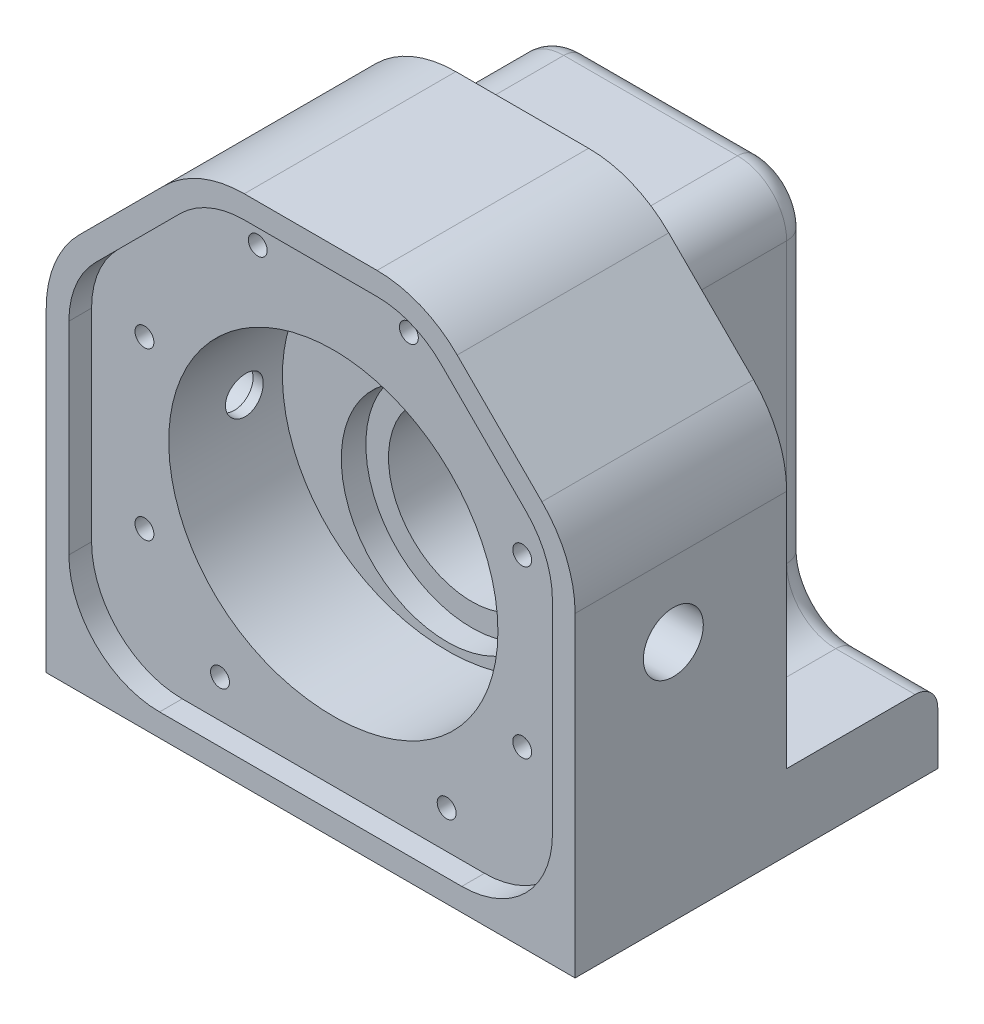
SolidWorks part; units mm, degrees
ref_plane "Face" through (0, 0, 0) normal (0, 0, 1) x (1, 0, 0)
ref_plane "Dessus" through (0, 0, 0) normal (0, 1, 0) x (1, 0, 0)
ref_plane "Droite" through (0, 0, 0) normal (1, 0, 0) x (0, 0, -1)
sketch "Esquisse1" plane through (0, 0, 0) normal (0, 0, 1) x (1, 0, 0)
  line L1 (-35, -32) -> (35, -32)
  line L2 (-35, -32) -> (-35, 38)
  line L3 (-35, 38) -> (35, 38)
  line L4 (35, -32) -> (35, 38)
  dimension "D1" = 70
  dimension "D2" = 70
  dimension "D3" = 32
  dimension "D4" = 35
extrude "brut 70 x 70 x 50" add sketch "Esquisse1" along normal blind 50
sketch "Esquisse 1" plane through (0, 0, 0) normal (0, 0, -1) x (-1, 0, 0)
  line L4 (35, -32) -> (35, 38)
  line L5 (35, 38) -> (-35, 38)
  line L6 (-35, 38) -> (-35, -32)
  line L7 (-35, -32) -> (35, -32)
  line L8 (35, -32) -> (35, 38)
  line L9 (35, 38) -> (-35, 38)
  line L10 (-35, 38) -> (-35, -32)
  line L11 (-35, -32) -> (35, -32)
  dimension "D1" = 0
extrude "Surfaçage ph 10" cut sketch "Esquisse 1" against normal blind 1
sketch "Esquisse 2" plane through (0, 0, 1) normal (0, 0, -1) x (-1, 0, 0)
  line L0 (-35, -22) -> (-24.5, -22)
  line L1 (-18, -15.5) -> (-18, 21.5)
  line L2 (-11.5, 28) -> (11.5, 28)
  line L3 (18, 21.5) -> (18, -15.5)
  line L4 (-35, -32) -> (35, -32)
  line L5 (35, -32) -> (35, 38)
  line L6 (35, 38) -> (-35, 38)
  line L7 (-35, 38) -> (-35, -32)
  line L8 (-35, -32) -> (35, -32)
  line L9 (35, -32) -> (35, -22)
  line L11 (-35, -22) -> (-35, -32)
  line L12 (24.5, -22) -> (35, -22)
  arc A0 (-24.5, -22) -> (-18, -15.5) centre (-24.5, -15.5) ccw
  arc A1 (-18, 21.5) -> (-11.5, 28) centre (-11.5, 21.5) cw
  arc A2 (18, 21.5) -> (11.5, 28) centre (11.5, 21.5) ccw
  arc A3 (18, -15.5) -> (24.5, -22) centre (24.5, -15.5) ccw
  point P15 (-18, 28)
  point P18 (18, 28)
  dimension "D6" = 6.5
  dimension "D2" = 10
  dimension "D3" = 60
  dimension "D4" = 18
  dimension "D5" = 36
  dimension "D1" = 0
extrude "Contournage ph 10" cut sketch "Esquisse 2" against normal blind 20 flip side to cut
fillet "Arrondi ph 10" radius 3 9 edges at (29.75, -22, 1) (19.9038, -20.0962, 1) (18, 3, 1) (16.0962, 26.0962, 1) (0, 28, 1) (-16.0962, 26.0962, 1) (-18, 3, 1) (-19.9038, -20.0962, 1) (-29.75, -22, 1)
sketch "Esquisse 3" plane through (0, 0, 50) normal (0, 0, 1) x (1, 0, 0)
  line L4 (-35, 38) -> (-35, -32)
  line L5 (-35, -32) -> (35, -32)
  line L6 (35, -32) -> (35, 38)
  line L7 (35, 38) -> (-35, 38)
  line L8 (-35, 38) -> (-35, -32)
  line L9 (-35, -32) -> (35, -32)
  line L10 (35, -32) -> (35, 38)
  line L11 (35, 38) -> (-35, 38)
  dimension "D1" = 0
extrude "Surfaçage ph 20" cut sketch "Esquisse 3" against normal offset from surface (1 mm away) 48
sketch "Esquisse 4" plane through (0, 0, 49) normal (0, 0, 1) x (1, 0, 0)
  line L0 (-35, -32) -> (35, -32) construction
  line L1 (19.3934, 31.6066) -> (30.6066, 20.3934)
  line L2 (-19.3934, 31.6066) -> (-30.6066, 20.3934)
  line L3 (-35, 38) -> (-35, -32) construction
  line L4 (35, 38) -> (-35, 38)
  line L5 (-35, 38) -> (-35, -32)
  line L6 (-35, -32) -> (35, -32)
  line L7 (35, -32) -> (35, 38)
  line L9 (-35, 9.7868) -> (-35, -32)
  line L10 (-35, -32) -> (35, -32)
  line L11 (35, -32) -> (35, 9.7868)
  line L14 (-8.7868, 36) -> (8.7868, 36)
  arc A0 (-19.3934, 31.6066) -> (-8.7868, 36) centre (-8.7868, 21) cw
  arc A1 (-30.6066, 20.3934) -> (-35, 9.7868) centre (-20, 9.7868) ccw
  arc A2 (30.6066, 20.3934) -> (35, 9.7868) centre (20, 9.7868) cw
  arc A3 (19.3934, 31.6066) -> (8.7868, 36) centre (8.7868, 21) ccw
  point P14 (-15, 36)
  point P19 (15, 36)
  dimension "D6" = 20
  dimension "D7" = 15
  dimension "D8" = 15
  dimension "D2" = 135
  dimension "D3" = 135
  dimension "D4" = 68
  dimension "D5" = 30
  dimension "D1" = 0
extrude "Contour ph 20" cut sketch "Esquisse 4" against normal blind 30 flip side to cut
sketch "Esquisse 5" plane through (0, 0, 49) normal (0, 0, 1) x (1, 0, 0)
  circle A0 centre (0, -6) radius 8.25
  dimension "D1" = 16.5
  dimension "D2" = 6
extrude "Perçage Ø16,5  ph 20" cut sketch "Esquisse 5" against normal through all
sketch "Positions points" plane through (0, 0, 49) normal (0, 0, 1) x (1, 0, 0)
  point P0 (0, 21)
  point P1 (2.351, 20.875)
  point P2 (4.673, 20.5)
  point P3 (6.935, 19.883)
  point P5 (11.173, 17.961)
  point P6 (9.111, 19.032)
  point P7 (13.098, 16.687)
  point P8 (14.864, 15.228)
  point P9 (16.453, 13.608)
  point P10 (17.849, 11.849)
  point P11 (19.041, 9.978)
  point P12 (20.021, 8.019)
  point P13 (20.785, 6)
  point P14 (21.331, 3.947)
  point P15 (21.662, 1.884)
  point P16 (21.784, -0.163)
  point P17 (21.707, -2.172)
  point P18 (21.441, -4.124)
  point P19 (20.399, -7.785)
  point P20 (21, -6)
  point P21 (19.655, -9.466)
  point P22 (18.784, -11.033)
  point P23 (17.805, -12.481)
  point P24 (16.734, -13.803)
  point P25 (15.588, -15)
  point P26 (14.383, -16.071)
  point P27 (13.133, -17.019)
  point P28 (11.849, -17.849)
  point P29 (10.544, -18.566)
  point P30 (9.226, -19.176)
  point P31 (7.902, -19.687)
  point P32 (6.577, -20.104)
  point P33 (5.254, -20.435)
  point P34 (3.935, -20.686)
  point P35 (2.621, -20.862)
  point P36 (1.309, -20.966)
  point P37 (0, -21)
  point P40 (-1.309, -20.966)
  point P41 (-2.621, -20.862)
  point P42 (-3.935, -20.686)
  point P43 (-5.254, -20.435)
  point P44 (-6.577, -20.104)
  point P45 (-7.902, -19.687)
  point P46 (-9.226, -19.176)
  point P47 (-10.544, -18.566)
  point P48 (-11.849, -17.849)
  point P49 (-13.133, -17.019)
  point P50 (-14.383, -16.071)
  point P51 (-15.588, -15)
  point P52 (-16.734, -13.803)
  point P53 (-17.805, -12.481)
  point P54 (-18.784, -11.033)
  point P55 (-19.655, -9.466)
  point P56 (-21, -6)
  point P57 (-20.399, -7.785)
  point P58 (-21.441, -4.124)
  point P59 (-21.707, -2.172)
  point P60 (-21.784, -0.163)
  point P61 (-21.662, 1.884)
  point P62 (-21.331, 3.947)
  point P63 (-20.785, 6)
  point P64 (-20.021, 8.019)
  point P65 (-19.041, 9.978)
  point P66 (-17.849, 11.849)
  point P67 (-16.453, 13.608)
  point P68 (-14.864, 15.228)
  point P69 (-13.098, 16.687)
  point P70 (-9.111, 19.032)
  point P71 (-11.173, 17.961)
  point P72 (-6.935, 19.883)
  point P73 (-4.673, 20.5)
  point P74 (-2.351, 20.875)
curve "Courbe2"
sketch "Esquisse 6" plane through (0, 0, 49) normal (0, 0, 1) x (1, 0, 0)
  line L18 (8.7868, 33) -> (-8.7868, 33)
  line L19 (28.4853, 18.2721) -> (17.2721, 29.4853)
  line L20 (32, -29) -> (32, 9.7868)
  line L21 (-32, -29) -> (32, -29)
  line L22 (-32, 9.7868) -> (-32, -29)
  line L23 (-17.2721, 29.4853) -> (-28.4853, 18.2721)
  line L24 (8.7868, 33) -> (-8.7868, 33)
  line L25 (28.4853, 18.2721) -> (17.2721, 29.4853)
  line L26 (32, -17) -> (32, 9.7868)
  line L27 (-20, -29) -> (20, -29)
  line L28 (-32, 9.7868) -> (-32, -17)
  line L29 (-17.2721, 29.4853) -> (-28.4853, 18.2721)
  arc A8 (-20, -29) -> (-32, -17) centre (-20, -17) cw
  arc A9 (32, -17) -> (20, -29) centre (20, -17) cw
  arc A12 (-8.7868, 33) -> (-17.2721, 29.4853) centre (-8.7868, 21) ccw
  arc A13 (17.2721, 29.4853) -> (8.7868, 33) centre (8.7868, 21) ccw
  arc A14 (32, 9.7868) -> (28.4853, 18.2721) centre (20, 9.7868) ccw
  arc A15 (-28.4853, 18.2721) -> (-32, 9.7868) centre (-20, 9.7868) ccw
  arc A16 (-8.7868, 33) -> (-17.2721, 29.4853) centre (-8.7868, 21) ccw
  arc A17 (17.2721, 29.4853) -> (8.7868, 33) centre (8.7868, 21) ccw
  arc A18 (32, 9.7868) -> (28.4853, 18.2721) centre (20, 9.7868) ccw
  arc A19 (-28.4853, 18.2721) -> (-32, 9.7868) centre (-20, 9.7868) ccw
  dimension "D1" = 3
  dimension "D2" = 12
extrude "Logement pléxiglass ph 20" cut sketch "Esquisse 6" against normal blind 3
sketch "Esquisse 7" plane through (0, 0, 46) normal (0, 0, 1) x (1, 0, 0)
  point P0 (0, 21)
  dimension "D1" = 0
extrude "Concoïde ph 20" cut sketch "Esquisse 7" against normal blind 15.05
sketch "Esquisse 8" plane through (0, 0, 30.95) normal (0, 0, 1) x (1, 0, 0)
  circle A0 centre (0, -6) radius 14
  dimension "D1" = 28
extrude "Logement colerette ph 20" cut sketch "Esquisse 8" against normal blind 3.25
sketch "Esquisse 9" plane through (0, 0, 27.7) normal (0, 0, 1) x (1, 0, 0)
  circle A0 centre (0, -6) radius 11
  dimension "D1" = 22
extrude "Alésage bague ph20" cut sketch "Esquisse 9" against normal blind 23
sketch "Esquisse 10" plane through (0, 0, 46) normal (0, 0, 1) x (1, 0, 0)
  circle A0 centre (0, 0) radius 28.5
  circle A1 centre (0, 0) radius 25
  dimension "D1" = 57
  dimension "D2" = 50
extrude "Logement joint ph20" [suppressed] cut sketch "Esquisse 10" against normal blind 3.3
hole_wizard "Trou taraudé M3x0.5 ph20" positions "Esquisse 11" profile "Esquisse 12" tap size "M3x0.5" standard "Ansi Métrique"
sketch "Esquisse 11" plane through (0, 0, 46) normal (0, 0, 1) x (1, 0, 0)
  point P0 (-15, -24)
  point P1 (-25, -12)
  point P2 (-25, 10)
  point P3 (-10, 28)
  point P4 (10, 28)
  point P5 (25, 10)
  point P6 (25, -12)
  point P7 (15, -24)
  dimension "D1" = 25
  dimension "D2" = 10
  dimension "D3" = 28
  dimension "D4" = 10
  dimension "D5" = 20
  dimension "D6" = 50
  dimension "D7" = 12
  dimension "D8" = 24
  dimension "D9" = 15
  dimension "D10" = 30
sketch "Esquisse 12" plane through (-15, -24, 46) normal (1, 0, 0) x (0, -1, 0)
  line L0 (0, 0) -> (0, 9.2511)
  line L1 (0, 9.2511) -> (1.25, 8.5)
  line L2 (1.25, 8.5) -> (1.25, 0)
  line L5 (1.25, 0) -> (0, 0)
  line L10 (0, 9.2511) -> (-1.25, 8.5) construction
  line L11 (0, -6.35) -> (0, 107.95) construction
  dimension "Diamètre du perçage" = 2.5
  dimension "Profondeur du perçage" = 8.5
  dimension "Angle de pointe" = 118
sketch "Esquisse 13" plane through (35, 0, 0) normal (1, 0, 0) x (0, 0, -1)
  line L0 (-49, -32) -> (-49, 9.7868) construction
  circle A0 centre (-36, 0) radius 2.5
  dimension "D2" = 5
  dimension "D1" = 13
extrude "Percage Ø5 ph 30" cut sketch "Esquisse 13" against normal through all
hole_wizard "Trou taraudé 3/8-16 ph 30" positions "Esquisse 14" profile "Esquisse 15" tap size "3/8-16" standard "Ansi Pouce"
sketch "Esquisse 14" plane through (-35, 0, 0) normal (-1, 0, 0) x (0, 0, 1)
  circle A0 centre (36, 0) radius 2.5 construction
  point P0 (36, 0)
sketch "Esquisse 15" plane through (-35, 0, 36) normal (0, 1, 0) x (0, 0, 1)
  line L0 (0, 0) -> (0, 13.3847)
  line L1 (0, 13.3847) -> (3.9687, 11)
  line L2 (3.9687, 11) -> (3.9687, 0)
  line L5 (3.9687, 0) -> (0, 0)
  line L10 (0, 13.3847) -> (-3.9688, 11) construction
  line L11 (0, -6.35) -> (0, 107.95) construction
  dimension "Diamètre du perçage" = 7.9375
  dimension "Profondeur du perçage" = 11
  dimension "Angle de pointe" = 118
hole_wizard "Trou taraudé 3/8-16   ph 30" positions "Esquisse 16" profile "Esquisse 17" tap size "3/8-16" standard "Ansi Pouce"
sketch "Esquisse 16" plane through (35, 0, 0) normal (1, 0, 0) x (0, 0, -1)
  circle A0 centre (-36, 0) radius 2.5 construction
  point P0 (-36, 0)
sketch "Esquisse 17" plane through (35, 0, 36) normal (0, 1, 0) x (0, 0, -1)
  line L0 (0, 0) -> (0, 13.3847)
  line L1 (0, 13.3847) -> (3.9687, 11)
  line L2 (3.9687, 11) -> (3.9687, 0)
  line L5 (3.9687, 0) -> (0, 0)
  line L10 (0, 13.3847) -> (-3.9688, 11) construction
  line L11 (0, -6.35) -> (0, 107.95) construction
  dimension "Diamètre du perçage" = 7.9375
  dimension "Profondeur du perçage" = 11
  dimension "Angle de pointe" = 118
